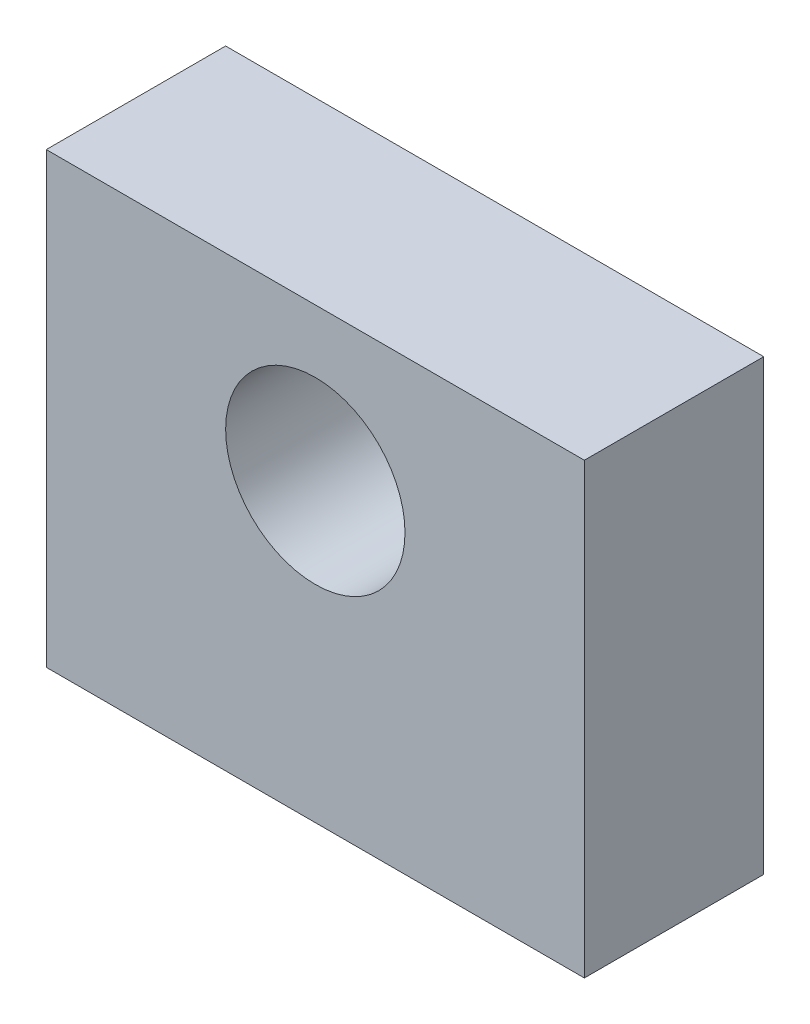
SolidWorks part; units mm, degrees
ref_plane "Plan de face" through (0, 0, 0) normal (0, 0, 1) x (1, 0, 0)
ref_plane "Plan de dessus" through (0, 0, 0) normal (0, 1, 0) x (1, 0, 0)
ref_plane "Plan de droite" through (0, 0, 0) normal (1, 0, 0) x (0, 0, -1)
sketch "Esquisse1" plane through (0, 0, 0) normal (0, 1, 0) x (1, 0, 0)
  line L1 (-30, 0) -> (30, 0)
  line L2 (-30, 0) -> (-30, 20)
  line L3 (-30, 20) -> (30, 20)
  line L4 (30, 0) -> (30, 20)
  dimension "D1" = 20
  dimension "D2" = 60
extrude "Extrusion1" add sketch "Esquisse1" along normal blind 50
hole_wizard "Trou taraudé M81" positions "Esquisse3" profile "Esquisse2" tap size "M8" standard "ISO"
sketch "Esquisse3" plane through (0, 0, 0) normal (0, -1, 0) x (1, 0, 0)
  line L0 (-30, 0) -> (30, 0) construction
  line L1 (-30, -20) -> (-30, 0) construction
  point P0 (-18, -10)
  point P1 (18, -10)
  dimension "D1" = 36
  dimension "D2" = 10
  dimension "D3" = 12
sketch "Esquisse2" plane through (-18, 0, -10) normal (1, 0, 0) x (0, 0, -1)
  line L0 (0, 0) -> (0, 24.2929)
  line L1 (0, 24.2929) -> (3.4, 22.25)
  line L2 (3.4, 22.25) -> (3.4, 0)
  line L5 (3.4, 0) -> (0, 0)
  line L10 (0, 24.2929) -> (-3.4, 22.25) construction
  line L11 (0, -6.35) -> (0, 107.95) construction
  dimension "Diamètre du trou pour taraudage" = 6.8
  dimension "Profondeur du trou pour taraudage" = 22.25
  dimension "Angle de pointe" = 118
sketch "Esquisse4" plane through (0, 0, -20) normal (0, 0, -1) x (-1, 0, 0)
  line L0 (-30, 0) -> (30, 0) construction
  circle A0 centre (0, 33) radius 10
  dimension "D2" = 20
  dimension "D1" = 33
extrude "Enlèv. mat.-Extru.1" cut sketch "Esquisse4" against normal up to next
